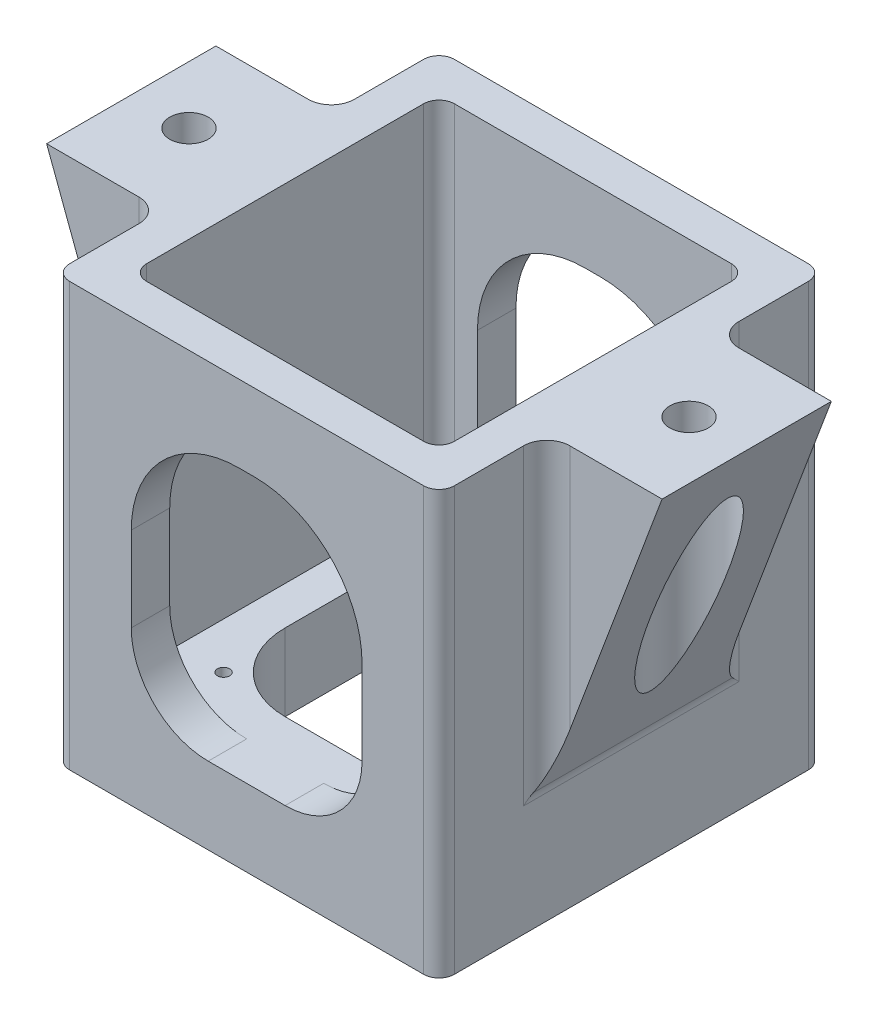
SolidWorks part; units mm, degrees
ref_plane "Plano frontal" through (0, 0, 0) normal (0, 0, 1) x (1, 0, 0)
ref_plane "Plano superior" through (0, 0, 0) normal (0, 1, 0) x (1, 0, 0)
ref_plane "Plano direito" through (0, 0, 0) normal (1, 0, 0) x (0, 0, -1)
sketch "Esboço1" plane through (0, 0, 0) normal (0, 1, 0) x (1, 0, 0)
  line L1 (-25, -25) -> (25, -25)
  line L2 (-25, -25) -> (-25, 25)
  line L3 (-25, 25) -> (25, 25)
  line L4 (25, -25) -> (25, 25)
  line L5 (-25, -25) -> (25, 25) construction
  line L6 (-25, 25) -> (25, -25) construction
  point P0 (0, 0)
  dimension "D1" = 50
  dimension "D2" = 50
extrude "Ressalto-extrusão1" add sketch "Esboço1" along normal blind 55
sketch "Esboço2" plane through (0, 55, 0) normal (0, 1, 0) x (1, 0, 0)
  line L0 (-25, -25) -> (25, -25) construction
  line L1 (25, -25) -> (25, 25) construction
  line L2 (25, 25) -> (-25, 25) construction
  line L3 (-25, 25) -> (-25, -25) construction
  line L4 (-25, -25) -> (25, -25) construction
  line L5 (25, -25) -> (25, 25) construction
  line L6 (25, 25) -> (-25, 25) construction
  line L7 (-25, 25) -> (-25, -25) construction
  line L8 (-20, -20) -> (20, -20)
  line L9 (20, -20) -> (20, 20)
  line L10 (20, 20) -> (-20, 20)
  line L11 (-20, 20) -> (-20, -20)
  dimension "D1" = 5
extrude "Corte-extrusão2" cut sketch "Esboço2" along direction (0, -1, 0) on the side against the normal offset from surface (45 mm away) 10 contours L8 L9 L10 L11
sketch "Esboço3" plane through (0, 10, 0) normal (0, 1, 0) x (1, 0, 0)
  line L0 (5, 15) -> (-5, 15)
  line L1 (-15, 5) -> (-15, -5)
  line L2 (-5, -15) -> (5, -15)
  line L3 (15, -5) -> (15, 5)
  line L4 (-20, 20) -> (-20, -20)
  line L5 (-20, -20) -> (20, -20)
  line L6 (20, -20) -> (20, 20)
  line L7 (20, 20) -> (-20, 20)
  line L8 (-20, 20) -> (-20, -20) construction
  line L9 (-20, -20) -> (20, -20) construction
  line L10 (20, -20) -> (20, 20) construction
  line L11 (20, 20) -> (-20, 20) construction
  line L12 (-15, 15) -> (-15, -15) construction
  line L13 (-15, -15) -> (15, -15) construction
  line L14 (15, -15) -> (15, 15) construction
  line L15 (15, 15) -> (-15, 15) construction
  arc A0 (-15, -5) -> (-5, -15) centre (-5, -5) ccw
  arc A1 (5, -15) -> (15, -5) centre (5, -5) ccw
  arc A2 (5, 15) -> (15, 5) centre (5, 5) cw
  arc A3 (-5, 15) -> (-15, 5) centre (-5, 5) ccw
  dimension "D3" = 10
  dimension "D1" = 0
  dimension "D2" = 5
extrude "Corte-extrusão4" cut sketch "Esboço3" against normal up to surface (10 mm away)
sketch "Esboço4" plane through (0, 10, 0) normal (0, 1, 0) x (1, 0, 0)
  line L0 (0, 0) -> (0, 29.6767) construction
  circle A0 centre (-14, 14) radius 1
  circle A1 centre (14, 14) radius 1
  circle A2 centre (14, -14) radius 1
  circle A3 centre (-14, -14) radius 1
  point P14 (0, 0)
  dimension "D1" = 2
  dimension "D3" = 14
  dimension "D5" = 14
  dimension "D6" = 14
  dimension "D2" = 14
  dimension "D4" = 4
extrude "Ressalto-extrusão2" [suppressed] add sketch "Esboço4" along normal blind 5 draft 4
sketch "Esboço5" plane through (0, 0, 0) normal (0, 0, 1) x (1, 0, 0)
  line L0 (25, 55) -> (25, 0) construction
  line L1 (25, 55) -> (25, 15)
  line L2 (25, 55) -> (40, 55)
  line L3 (40, 55) -> (25, 15)
  line L4 (25, 55) -> (25, 0) construction
  dimension "D1" = 15
  dimension "D2" = 40
extrude "Ressalto-extrusão3" add sketch "Esboço5" along normal mid plane 22
sketch "Esboço6" plane through (0, 55, 0) normal (0, 1, 0) x (1, 0, 0)
  line L0 (0, 0) -> (47.7743, 0) construction
  line L1 (40, 11) -> (25, 11) construction
  line L2 (40, 11) -> (25, 11) construction
  line L3 (32.5, 11) -> (32.5, -11) construction
  line L4 (40, -11) -> (25, -11) construction
  circle A0 centre (32.5, 0) radius 2.5
  point P6 (32.5, 0)
  dimension "D1" = 5
extrude "Corte-extrusão5" cut sketch "Esboço6" against normal through all
sketch "Esboço7" plane through (0, 55, 0) normal (0, 1, 0) x (1, 0, 0)
  circle A0 centre (32.5, 0) radius 2.5 construction
  circle A1 centre (32.5, 0) radius 2.5 construction
  circle A2 centre (32.5, 0) radius 5
  dimension "D1" = 10
extrude "Corte-extrusão8" cut sketch "Esboço7" against normal through all from offset 4
mirror "Espelhar5" about plane through (0, 0, 0) normal (1, 0, 0) of "Corte-extrusão8", "Corte-extrusão5", "Ressalto-extrusão3"
fillet "Filete1" radius 3 5 edges at (25, 35, -11) (25, 15, 0) (25, 35, 11) (-25, 35, -11) (-25, 35, 11)
sketch "Esboço8" plane through (0, 0, -25) normal (0, 0, -1) x (-1, 0, 0)
  line L9 (-5, 10) -> (5, 10)
  line L10 (15, 20) -> (15, 31)
  line L11 (1, 45) -> (-1, 45)
  line L12 (-15, 31) -> (-15, 20)
  line L13 (-25, 0) -> (25, 0)
  line L14 (25, 0) -> (25, 55)
  line L15 (25, 55) -> (-25, 55)
  line L16 (-25, 55) -> (-25, 0)
  line L17 (-25, 0) -> (25, 0) construction
  line L18 (25, 0) -> (25, 55) construction
  line L19 (25, 55) -> (-25, 55) construction
  line L20 (-25, 55) -> (-25, 0) construction
  line L21 (-15, 10) -> (15, 10) construction
  line L22 (-15, 45) -> (-15, 10) construction
  line L23 (15, 10) -> (15, 45) construction
  line L24 (15, 45) -> (-15, 45) construction
  arc A0 (-5, 10) -> (-15, 20) centre (-5, 20) cw
  arc A1 (5, 10) -> (15, 20) centre (5, 20) ccw
  arc A2 (15, 31) -> (1, 45) centre (1, 31) ccw
  arc A3 (-1, 45) -> (-15, 31) centre (-1, 31) ccw
  dimension "D3" = 10
  dimension "D4" = 14
  dimension "D1" = 0
  dimension "D2" = 10
extrude "Corte-extrusão9" cut sketch "Esboço8" against normal up to next
mirror "Espelhar8" about plane through (0, 0, 0) normal (0, 0, 1) of "Corte-extrusão9"
fillet "Filete2" radius 2 8 edges at (25, 27.5, 25) (-25, 27.5, 25) (-25, 27.5, -25) (25, 27.5, -25) (-20, 32.5, -20) (-20, 32.5, 20) (20, 32.5, -20) (20, 32.5, 20)
sketch "Esboço9" plane through (0, 10, 0) normal (0, 1, 0) x (1, 0, 0)
  circle A0 centre (14, -14) radius 0.8
  circle A1 centre (-14, -14) radius 0.8
  circle A2 centre (-14, 14) radius 0.8
  circle A3 centre (14, 14) radius 0.8
  dimension "D1" = 1.6
extrude "Corte-extrusão10" cut sketch "Esboço9" against normal up to next
